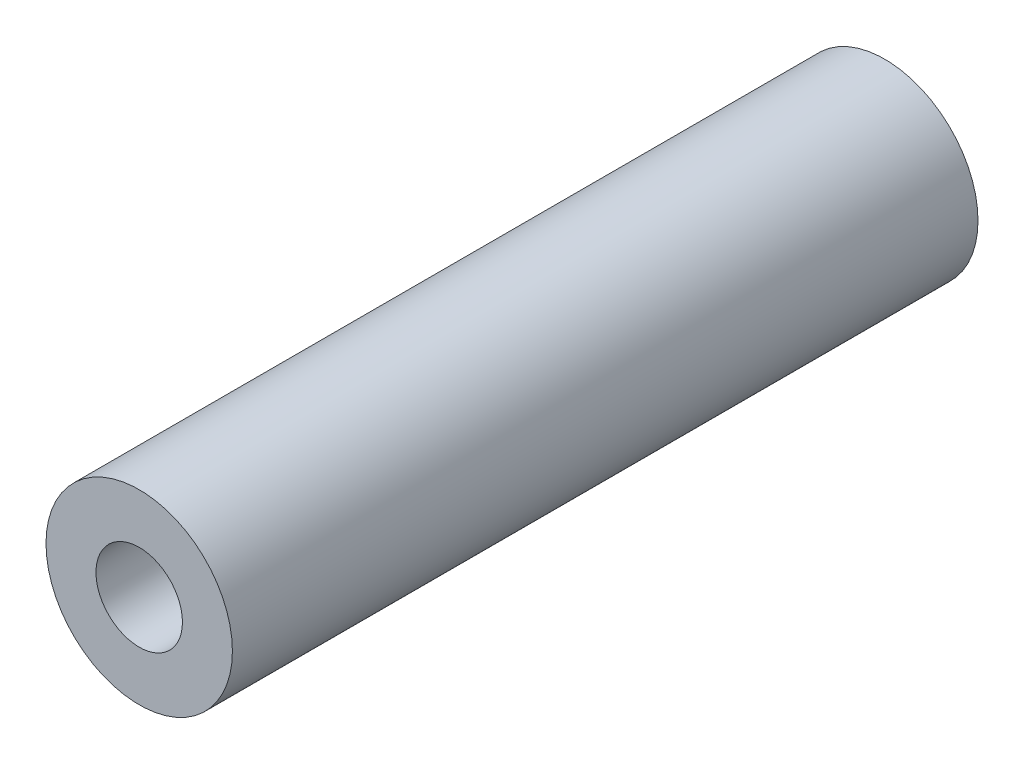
SolidWorks part; units mm, degrees
ref_plane "Front Plane" through (0, 0, 0) normal (0, 0, 1) x (1, 0, 0)
ref_plane "Top Plane" through (0, 0, 0) normal (0, 1, 0) x (1, 0, 0)
ref_plane "Right Plane" through (0, 0, 0) normal (1, 0, 0) x (0, 0, -1)
sketch "Sketch1" plane through (0, 0, 0) normal (0, 0, 1) x (1, 0, 0)
  circle A0 centre (0, 0) radius 3.175
  dimension "D1" = 6.35
extrude "Boss-Extrude1" add sketch "Sketch1" along normal blind 25.4
hole_wizard "#4 Clearance Hole1" positions "Sketch3" profile "Sketch2" hole size "#4" standard "ANSI Inch"
sketch "Sketch3" plane through (0, 0, 25.4) normal (0, 0, 1) x (1, 0, 0)
  point P0 (0, 0)
sketch "Sketch2" plane through (0, 0, 25.4) normal (1, 0, 0) x (0, -1, 0)
  line L0 (0, 0) -> (0, 25.4)
  line L1 (0, 25.4) -> (1.4732, 25.4)
  line L2 (1.4732, 25.4) -> (1.4732, 0)
  line L5 (1.4732, 0) -> (0, 0)
  line L11 (0, -6.35) -> (0, 107.95) construction
  dimension "Thru Hole Dia." = 2.9464
  dimension "Thru Hole Depth" = 25.4
